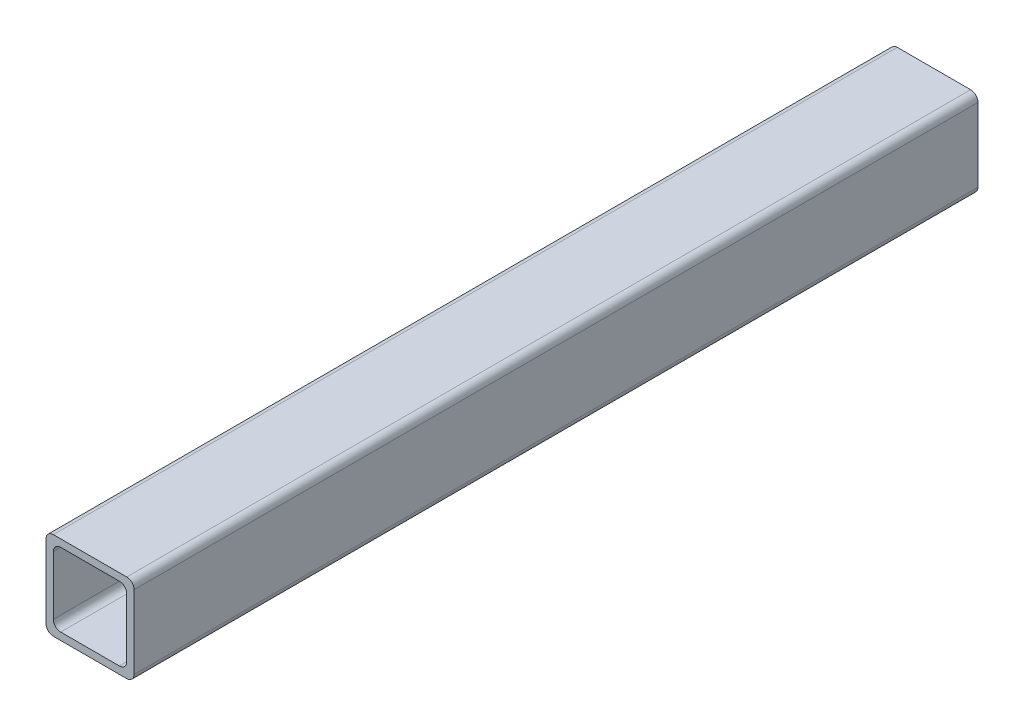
SolidWorks part; units mm, degrees
ref_plane "Front Plane" through (0, 0, 0) normal (0, 0, 1) x (1, 0, 0)
ref_plane "Top Plane" through (0, 0, 0) normal (0, 1, 0) x (1, 0, 0)
ref_plane "Right Plane" through (0, 0, 0) normal (1, 0, 0) x (0, 0, -1)
sketch "Sketch1" plane through (0, 0, 0) normal (0, 0, 1) x (1, 0, 0)
  line L1 (-50, -60) -> (50, -60)
  line L2 (-60, -50) -> (-60, 50)
  line L3 (-50, 60) -> (50, 60)
  line L4 (60, -50) -> (60, 50)
  line L5 (-60, -60) -> (60, 60) construction
  line L6 (-60, 60) -> (60, -60) construction
  line L7 (-40, -50) -> (40, -50)
  line L8 (-50, -40) -> (-50, 40)
  line L9 (-40, 50) -> (40, 50)
  line L10 (50, -40) -> (50, 40)
  line L11 (-50, -50) -> (50, 50) construction
  line L12 (-50, 50) -> (50, -50) construction
  arc A0 (50, -60) -> (60, -50) centre (50, -50) ccw
  arc A1 (50, 60) -> (60, 50) centre (50, 50) cw
  arc A2 (-60, 50) -> (-50, 60) centre (-50, 50) cw
  arc A3 (-50, -60) -> (-60, -50) centre (-50, -50) cw
  arc A4 (-40, -50) -> (-50, -40) centre (-40, -40) cw
  arc A5 (40, -50) -> (50, -40) centre (40, -40) ccw
  arc A6 (40, 50) -> (50, 40) centre (40, 40) cw
  arc A7 (-50, 40) -> (-40, 50) centre (-40, 40) cw
  point P0 (0, 0)
  point P6 (0, 0)
  dimension "D4" = 10
  dimension "D1" = 120
  dimension "D2" = 120
  dimension "D3" = 100
extrude "Boss-Extrude1" add sketch "Sketch1" along normal mid plane 1150
sketch "Sketch2" plane through (0, -60, 0) normal (0, -1, 0) x (1, 0, 0)
  line L0 (0, 0) -> (60, 0) construction
  line L1 (60, 575) -> (60, -575) construction
  line L2 (60, 0) -> (-60, 0) construction
  line L3 (-60, 575) -> (-60, -575) construction
  circle A0 centre (0, 498.5) radius 8.5
  circle A1 centre (0, -498.5) radius 8.5
  dimension "D1" = 17
  dimension "D2" = 498.5
  dimension "D3" = 60
extrude "Cut-Extrude1" cut sketch "Sketch2" against normal blind 10
